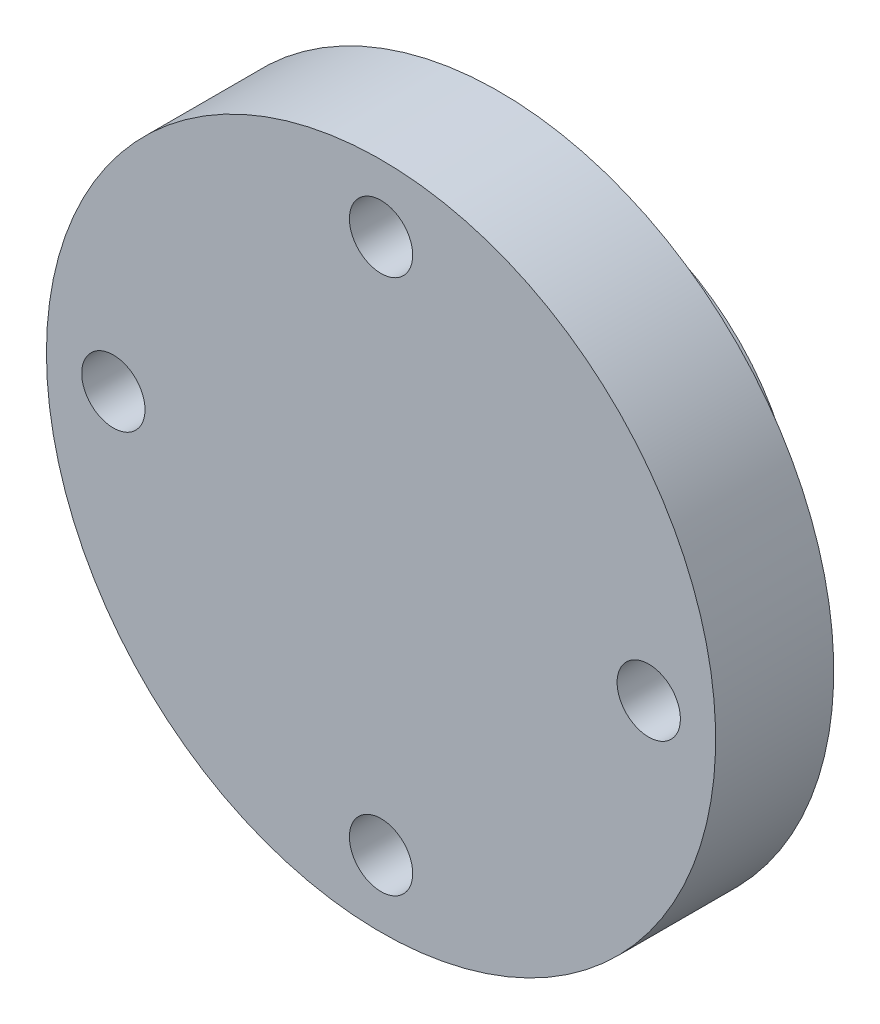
SolidWorks part; units mm, degrees
ref_plane "Front Plane" through (0, 0, 0) normal (0, 0, 1) x (1, 0, 0)
ref_plane "Top Plane" through (0, 0, 0) normal (0, 1, 0) x (1, 0, 0)
ref_plane "Right Plane" through (0, 0, 0) normal (1, 0, 0) x (0, 0, -1)
sketch "Sketch1" plane through (0, 0, 0) normal (0, 0, 1) x (1, 0, 0)
  circle A0 centre (0, 0) radius 26.9875
  dimension "D1" = 53.975
extrude "Boss-Extrude1" add sketch "Sketch1" along normal blind 9.525
sketch "Sketch3" plane through (0, 0, 0) normal (0, 0, -1) x (-1, 0, 0)
  circle A0 centre (0, 0) radius 16.5227
  dimension "D1" = 33.0454
extrude "Boss-Extrude2" add sketch "Sketch3" along normal blind 7.62
sketch "Sketch4" plane through (0, 0, 0) normal (0, 1, 0) x (1, 0, 0)
  line L0 (-16.5227, 2.4638) -> (-15.1765, 2.4638)
  line L1 (-16.5227, 7.62) -> (-16.5227, 0) construction
  line L2 (-15.1765, 2.4638) -> (-15.1765, 5.08)
  line L3 (-15.1765, 5.08) -> (-16.5227, 5.08)
  line L4 (16.5227, 7.62) -> (-16.5227, 7.62) construction
  line L5 (-16.5227, 2.4638) -> (-16.5227, 5.08)
  dimension "D1" = 2.54
  dimension "D2" = 1.3462
  dimension "D3" = 2.6162
ref_axis "Axis1" through (0, 0, -8.4772) along (0, 0, 1)
revolve "Cut-Revolve3" cut sketch "Sketch4" angle 360 about axis through (0, 0, -8.4772) along (0, 0, 1)
hole_wizard "#10 Clearance Hole1" positions "Sketch6" profile "Sketch5" hole size "#10" standard "ANSI Inch"
sketch "Sketch6" plane through (0, 0, 9.525) normal (0, 0, 1) x (1, 0, 0)
  circle A0 centre (0, 0) radius 21.59
  point P0 (0, -21.59)
  point P2 (21.59, 0)
  point P4 (0, 21.59)
  point P6 (-21.59, 0)
  dimension "D1" = 43.18
sketch "Sketch5" plane through (0, -21.59, 9.525) normal (1, 0, 0) x (0, -1, 0)
  line L0 (0, 0) -> (0, 9.525)
  line L1 (0, 9.525) -> (2.5527, 9.525)
  line L2 (2.5527, 9.525) -> (2.5527, 0)
  line L5 (2.5527, 0) -> (0, 0)
  line L11 (0, -6.35) -> (0, 107.95) construction
  dimension "Thru Hole Dia." = 5.1054
  dimension "Thru Hole Depth" = 9.525
